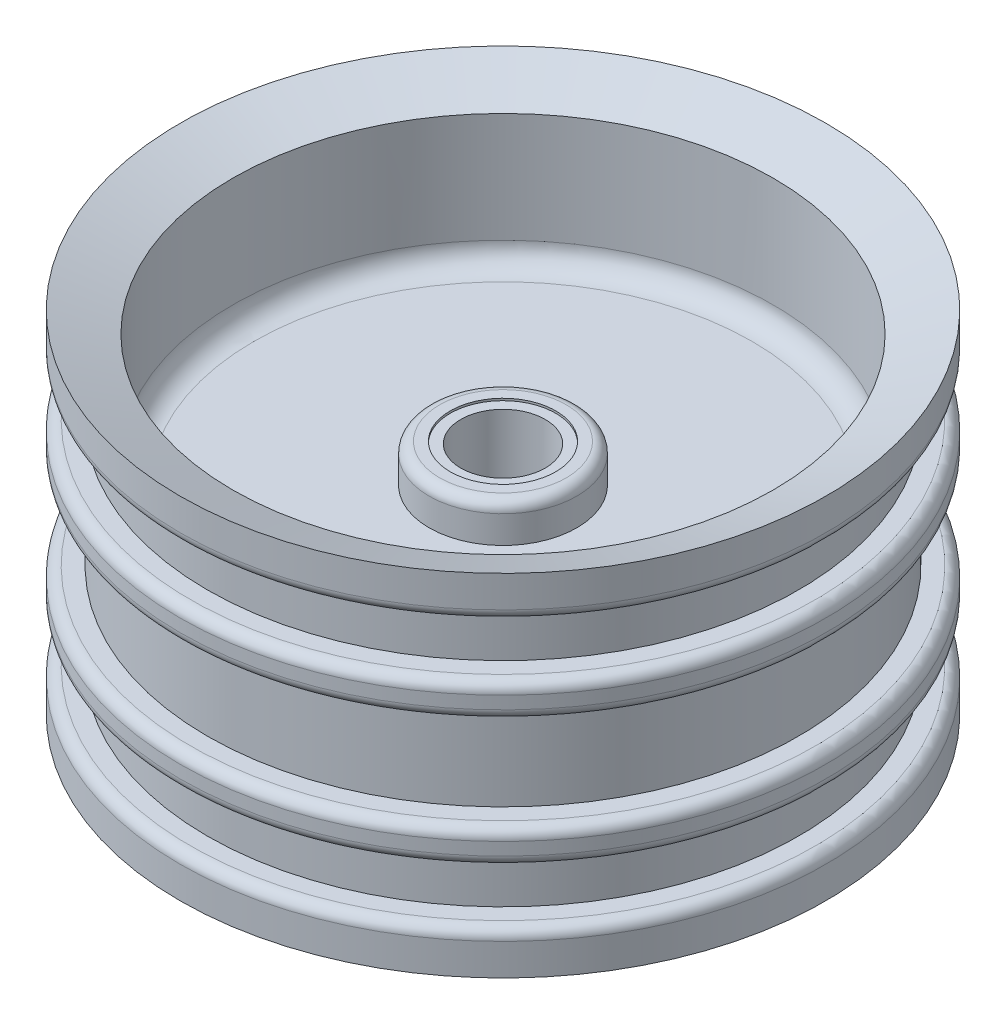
SolidWorks part; units mm, degrees
ref_plane "前视基准面" through (0, 0, 0) normal (0, 0, 1) x (1, 0, 0)
ref_plane "上视基准面" through (0, 0, 0) normal (0, 1, 0) x (1, 0, 0)
ref_plane "右视基准面" through (0, 0, 0) normal (1, 0, 0) x (0, 0, -1)
sketch "草图1" plane through (0, 0, 0) normal (0, 1, 0) x (1, 0, 0)
  circle A0 centre (0, 0) radius 14
  dimension "D1" = 28
extrude "凸台-拉伸1" add sketch "草图1" along normal blind 16.6
sketch "草图2" plane through (0, 0, 0) normal (0, 0, 1) x (1, 0, 0)
  line L0 (0, 0) -> (0, 8.3) construction
  line L1 (0, 8.3) -> (0, 16.6) construction
  line L2 (14, 16.6) -> (-14, 16.6) construction
  line L3 (0, 0) -> (15.3, 0) construction
  line L4 (15.3, 0) -> (15.3, 1.5)
  line L5 (14.8, 2) -> (14, 2)
  line L6 (14, 0) -> (14, 16.6) construction
  line L7 (14, 2) -> (14, 0)
  line L8 (14, 0) -> (15.3, 0)
  line L9 (0, 8.3) -> (14, 8.3) construction
  line L10 (14, 8.3) -> (14, 6.1) construction
  line L11 (14, 6.1) -> (14, 4.5)
  line L12 (14, 4.5) -> (14.8, 4.5)
  line L13 (15.3, 5) -> (15.3, 5.6)
  line L14 (14.8, 6.1) -> (14, 6.1)
  line L15 (14, 16.6) -> (15.3, 16.6)
  line L16 (14, 14.6) -> (14, 16.6)
  line L17 (15.3, 16.6) -> (15.3, 15.1)
  line L18 (14.8, 14.6) -> (14, 14.6)
  line L19 (15.3, 11.6) -> (15.3, 11)
  line L20 (14, 12.1) -> (14.8, 12.1)
  line L21 (14, 10.5) -> (14, 12.1)
  line L22 (14.8, 10.5) -> (14, 10.5)
  arc A0 (15.3, 1.5) -> (14.8, 2) centre (14.8, 1.5) ccw
  arc A1 (14.8, 4.5) -> (15.3, 5) centre (14.8, 5) ccw
  arc A2 (15.3, 5.6) -> (14.8, 6.1) centre (14.8, 5.6) ccw
  arc A3 (15.3, 15.1) -> (14.8, 14.6) centre (14.8, 15.1) cw
  arc A4 (15.3, 11) -> (14.8, 10.5) centre (14.8, 11) cw
  arc A5 (14.8, 12.1) -> (15.3, 11.6) centre (14.8, 11.6) cw
  point P19 (15.3, 2)
  point P22 (15.3, 4.5)
  dimension "D7" = 0.5
  dimension "D1" = 8.3
  dimension "D2" = 15.3
  dimension "D3" = 2
  dimension "D4" = 2.2
  dimension "D5" = 1.6
  dimension "D6" = 1.3
revolve "旋转1" add sketch "草图2" angle 360 about L1
sketch "草图3" plane through (0, 16.6, 0) normal (0, 1, 0) x (1, 0, 0)
  circle A0 centre (0, 0) radius 12.8
  dimension "D1" = 25.6
extrude "切除-拉伸1" cut sketch "草图3" against normal blind 7.2
sketch "草图4" plane through (0, 0, 0) normal (0, -1, 0) x (1, 0, 0)
  circle A0 centre (0, 0) radius 12.8
  dimension "D1" = 25.6
extrude "切除-拉伸2" cut sketch "草图4" against normal blind 7.8
sketch "草图5" plane through (0, 0, 0) normal (1, 0, 0) x (0, 0, -1)
  line L0 (15.3, 16.6) -> (12.8, 16.6)
  line L1 (15.3, 16.6) -> (-15.3, 16.6) construction
  line L2 (12.8, 16.6) -> (12.8, 15.6)
  line L3 (12.8, 15.6) -> (15.3, 16.6)
  line L4 (0, 0) -> (0, 8.3) construction
  line L5 (-15.3, 0) -> (15.3, 0) construction
  line L6 (0, 8.3) -> (0, 16.6) construction
  line L7 (0, 16.6) -> (12.8, 16.6) construction
  line L8 (0, 8.3) -> (5.8573, 8.3) construction
  line L11 (12.8, 0) -> (12.8, 1)
  line L12 (12.8, 1) -> (15.3, 0)
  line L13 (15.3, 0) -> (12.8, 0)
  dimension "D1" = 8.3
  dimension "D2" = 12.8
  dimension "D3" = 1
revolve "切除-旋转1" cut sketch "草图5" angle 360 about L6
sketch "草图6" plane through (0, 9.4, 0) normal (0, 1, 0) x (1, 0, 0)
  circle A0 centre (0, 0) radius 3.5
  dimension "D1" = 7
extrude "凸台-拉伸2" add sketch "草图6" along normal blind 1.8
sketch "草图7" plane through (0, 11.2, 0) normal (0, 1, 0) x (1, 0, 0)
  circle A0 centre (0, 0) radius 2.5
  dimension "D1" = 5
extrude "切除-拉伸3" cut sketch "草图7" against normal blind 0.1
sketch "草图8" plane through (0, 7.8, 0) normal (0, -1, 0) x (1, 0, 0)
  circle A0 centre (0, 0) radius 5
  dimension "D1" = 10
extrude "凸台-拉伸3" add sketch "草图8" along normal blind 7.5
sketch "草图10" plane through (0, 0.3, 0) normal (0, -1, 0) x (1, 0, 0)
  circle A0 centre (0, 0) radius 4.25
  dimension "D1" = 8.5
ref_plane "基准面1" through (0, -4.7, 0) normal (0, -1, 0) x (-1, 0, 0)
sketch "草图11" plane through (0, -4.7, 0) normal (0, -1, 0) x (-1, 0, 0)
  circle A0 centre (0, 0) radius 3.5
  dimension "D1" = 7
loft "放样1" add profiles "草图11", "草图10"
sketch "草图12" plane through (0, -4.7, 0) normal (0, -1, 0) x (1, 0, 0)
  line L0 (7, 0.5) -> (7, -0.5)
  line L1 (7, 0.5) -> (-7, 0.5)
  line L2 (7, -0.5) -> (-7, -0.5)
  line L3 (-7, 0.5) -> (-7, -0.5)
  line L4 (7, 0.5) -> (-7, -0.5) construction
  line L5 (7, -0.5) -> (-7, 0.5) construction
  point P1 (0, 0)
  dimension "D1" = 0.5
  dimension "D2" = 14
extrude "切除-拉伸4" cut sketch "草图12" against normal blind 12.5
sketch "草图13" plane through (0, -4.7, 0) normal (0, -1, 0) x (1, 0, 0)
  line L1 (0.4865, -3.567) -> (0.4865, 3.567)
  line L2 (-0.5, -3.5651) -> (-0.5, 3.5651)
  line L4 (0.5, -4) -> (-0.5, 4) construction
  line L5 (-0.5, -4) -> (0.5, 4) construction
  arc A0 (-0.5, -3.5651) -> (0.4865, -3.567) centre (0, 0) ccw
  arc A1 (0.4865, 3.567) -> (-0.5, 3.5651) centre (0, 0) ccw
  dimension "D1" = 7.2
  dimension "D2" = 0.5
  dimension "D3" = 8
extrude "切除-拉伸5" cut sketch "草图13" against normal blind 12.5
sketch "草图14" plane through (0, 11.1, 0) normal (0, 1, 0) x (1, 0, 0)
  circle A0 centre (0, 0) radius 2
  dimension "D1" = 4
extrude "切除-拉伸6" cut sketch "草图14" against normal through all
fillet "圆角1" radius 1 2 edges at (0, 9.4, 12.8) (0, 7.8, -12.8)
fillet "圆角2" radius 0.5 1 edges at (0, 11.2, 3.5)
